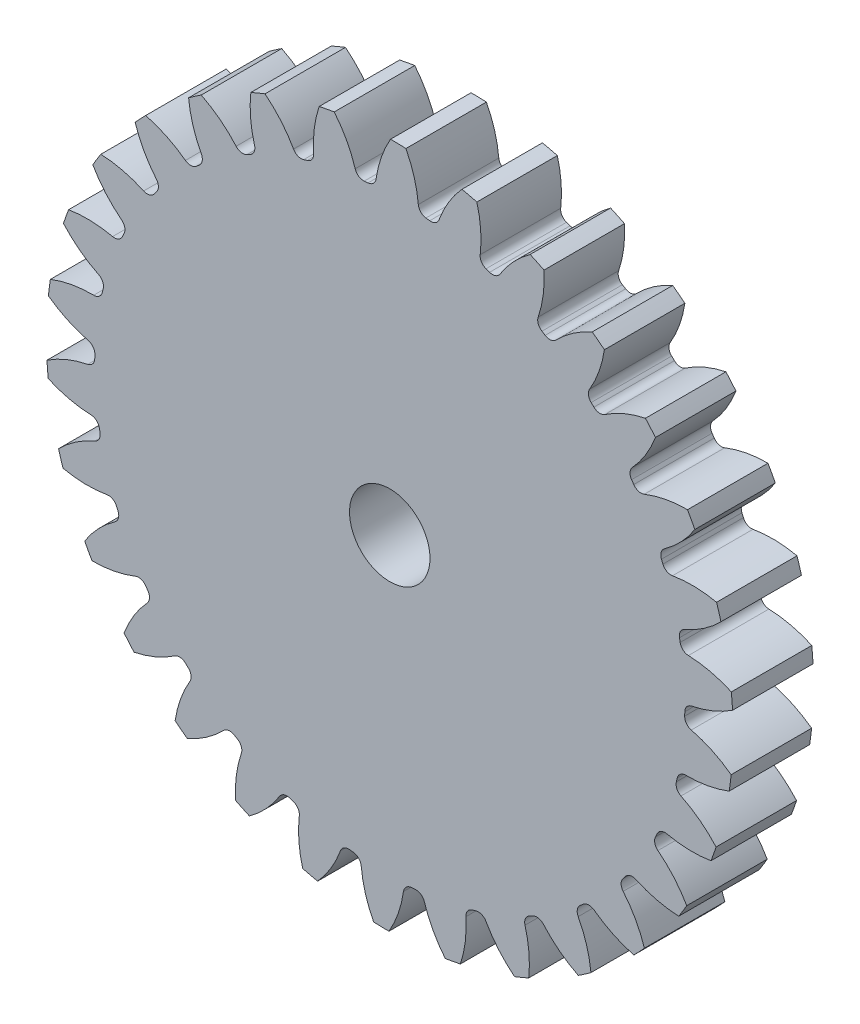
SolidWorks part; units mm, degrees
ref_plane "Front" through (0, 0, 0) normal (0, 0, 1) x (1, 0, 0)
ref_plane "Top" through (0, 0, 0) normal (0, 1, 0) x (1, 0, 0)
ref_plane "Right" through (0, 0, 0) normal (1, 0, 0) x (0, 0, -1)
sketch "Sketch3" plane through (0, 0, 0) normal (0, 0, 1) x (1, 0, 0)
  circle A0 centre (0, 0) radius 541.8667
  dimension "od" = 1083.7333
extrude "gearBody" add sketch "Sketch3" along normal blind 127
sketch "Sketch2" plane through (0, 0, 0) normal (0, 0, 1) x (1, 0, 0)
  line L0 (0, 0) -> (441.0267, 182.6792) construction
  line L1 (539.6374, -58.5242) -> (0, 0) construction
  line L2 (0, 0) -> (36.3143, 0) construction
  line L3 (507.8076, 13.9792) -> (506.5007, -39) construction
  line L5 (507.1542, -12.5104) -> (0, 0) construction
  line L7 (0, 0) -> (477.3639, 0) construction
  arc A0 (477.3386, 4.913) -> (476.5158, -28.4425) centre (0, 0) ccw construction
  arc A1 (540.965, 31.2469) -> (538.7664, -57.8816) centre (0, 0) ccw construction
  arc A2 (507.8076, 13.9792) -> (506.5007, -39) centre (0, 0) ccw construction
  arc A3 (465.4415, -14.4789) -> (465.5893, -8.4876) centre (0, 0) ccw
  arc A4 (539.6374, -58.5242) -> (475.8482, -28.2728) centre (431.4832, -204.2022) ccw
  arc A5 (539.6374, -58.5242) -> (541.8667, 31.8459) centre (0, 0) ccw
  arc A6 (541.8667, 31.8459) -> (476.6634, 4.7764) centre (441.0267, 182.6792) cw
  arc A7 (465.5893, -8.4876) -> (476.6634, 4.7764) centre (479.3708, -8.7389) cw
  arc A8 (475.8482, -28.2728) -> (465.4415, -14.4789) centre (479.2186, -14.9075) cw
  point P6 (541.8667, 31.8459)
  point P22 (539.6374, -58.5242)
  dimension "baseDia" = 954.7277
  dimension "od" = 1083.7333
  dimension "pd" = 1016
  dimension "rd" = 931.3333
  dimension "rFillet" = 13.7837
  dimension "pointX" = 541.8667
  dimension "pointY" = 31.8459
  dimension "CTT" = 52.9791
  dimension "flankCenterAngle" = 22.5
extrude "toothCut" cut sketch "Sketch2" along normal through all
pattern_circular "CirPattern1" count 30 over 360 about axis through (0, 0, 0) along (0, 0, 1) of "toothCut"
sketch "hub1Dia" plane through (0, 0, 0) normal (0, 0, -1) x (-1, 0, 0)
  circle A0 centre (0, 0) radius 12.7
  dimension "hub1Dia" = 25.4
sketch "hub2Dia" plane through (0, 0, 127) normal (0, 0, 1) x (1, 0, 0)
  circle A0 centre (0, 0) radius 12.7
  dimension "hub2dia" = 25.4
sketch "boreDia" plane through (0, 0, 0) normal (0, 0, 1) x (1, 0, 0)
  circle A0 centre (0, 0) radius 63.5
  dimension "boreDia" = 127
extrude "bore" cut sketch "boreDia" against normal mid plane 25400
